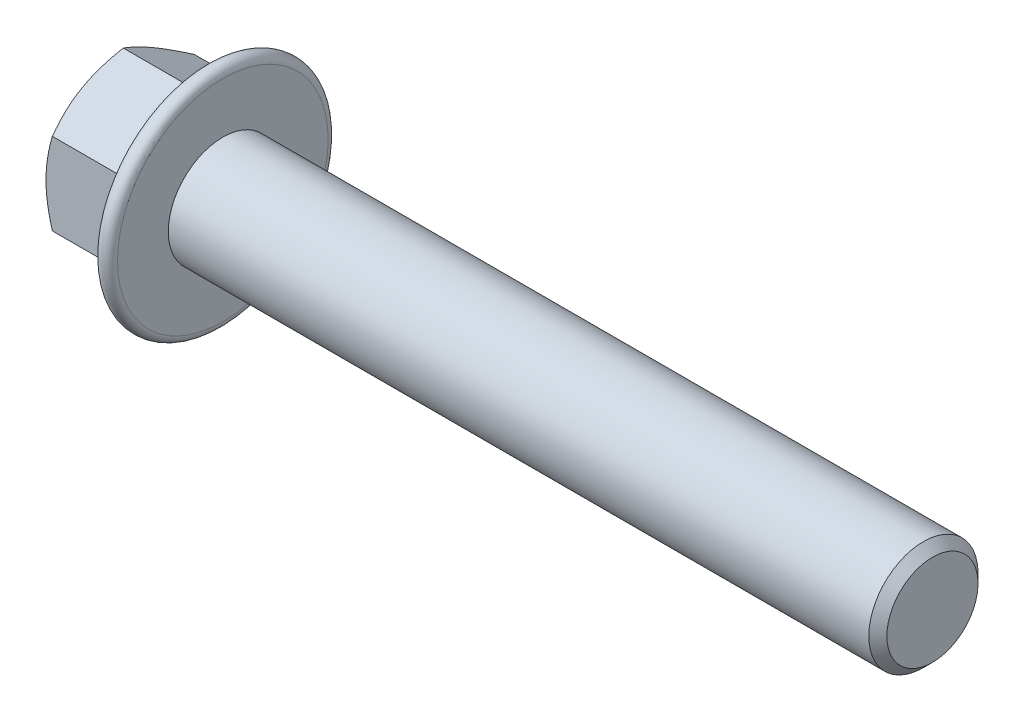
SolidWorks part; units mm, degrees
extrude "BaseHead" add sketch "Sketch1" along normal blind 9.7
sketch "Sketch1" plane through (0, 0, 0) normal (1, 0, 0) x (0, 0, -1)
  line L0 (6.5, 3.7528) -> (6.5, -3.7528)
  line L1 (-6.5, 3.7528) -> (-6.5, -3.7528)
  line L2 (6.5, -3.7528) -> (0, -7.5056)
  line L3 (0, -7.5056) -> (-6.5, -3.7528)
  line L4 (6.5, 3.7528) -> (0, 7.5056)
  line L5 (0, 7.5056) -> (-6.5, 3.7528)
ref_plane "Plane1" through (0, 0, 0) normal (0, 0, 1) x (1, 0, 0)
ref_plane "Plane2" through (0, 0, 0) normal (0, 1, 0) x (1, 0, 0)
ref_plane "Plane3" through (0, 0, 0) normal (1, 0, 0) x (0, 0, -1)
sketch "BodySke" plane through (0, 0, 0) normal (0, 0, 1) x (1, 0, 0)
  line L0 (0, 3.7528) -> (0, -3.7528) construction
  line L1 (0, 0) -> (74.7, 0)
  line L2 (0, 0) -> (0, 5)
  line L3 (0, 5) -> (73.872, 5)
  line L4 (74.7, 0) -> (74.7, 4.172)
  line L5 (9.7, 7.5056) -> (9.7, 3.7528) construction
  line L6 (74.7, 4.172) -> (73.872, 5)
  line L7 (0, 0) -> (96.52, 0) construction
  line L8 (74.7, -4.172) -> (73.872, -5) construction
  line L9 (0, -5) -> (73.872, -5) construction
  line L10 (11.2, 15.24) -> (11.2, -1.27) construction
  line L11 (48.7, 15.24) -> (48.7, -1.27) construction
  line L12 (9.7, 3.7528) -> (9.7, -3.7528) construction
revolve "BaseBody" add sketch "BodySke"
fillet "HeadFillet" [suppressed] radius 0.4
sketch "Sketch3" plane through (0, 0, 0) normal (0, 0, 1) x (1, 0, 0)
  line L0 (0, 6.5) -> (3.4673, 12.5056)
  line L1 (0, 7.5056) -> (0, 3.7528) construction
  line L2 (3.4673, 12.5056) -> (3.4673, 17.5056)
  line L3 (3.4673, 17.5056) -> (-10, 17.5056)
  line L4 (-10, 17.5056) -> (-10, 6.5)
  line L5 (-10, 6.5) -> (0, 6.5)
  line L6 (0, 0) -> (99.06, 0) construction
  line L7 (9.7, 7.5056) -> (0, 7.5056) construction
revolve "HeadChamfer" cut sketch "Sketch3" angle 360 about L6
sketch "Sketch4" plane through (0, 0, 0) normal (0, 0, 1) x (1, 0, 0)
  line L0 (4.6396, 0) -> (8.2452, 9.9065)
  line L1 (9.7, 7.5056) -> (9.7, 3.7528) construction
  line L2 (8.2, 34.3444) -> (8.2, 16.9779) construction
  line L3 (9.7, 0) -> (9.7, 9.65)
  line L4 (8.3021, 10.4) -> (20.1618, 10.4) construction
  line L5 (0, 0) -> (95.25, 0) construction
  line L6 (0, 0) -> (96.52, 0) construction
  line L7 (4.6396, 0) -> (9.7, 0)
  line L8 (8.3021, -10.4) -> (20.1618, -10.4) construction
  arc A0 (9.7, 9.65) -> (8.2452, 9.9065) centre (8.95, 9.65) ccw
  dimension "D1" = 20
  dimension "Flange_thickness" = 1.5
  dimension "Flange_dia" = 20.8
revolve "Flange" add sketch "Sketch4" angle 360 about L5
fillet "FlangeHexFillet" radius 0.6 6 edges
sketch "ThdSchSke" plane through (0, 0, 0) normal (0, 0, 1) x (1, 0, 0)
  line L0 (48.7, -4.172) -> (48.1202, -5)
  line L1 (48.7, -4.172) -> (49.2798, -5)
  line L2 (49.2798, -5) -> (49.2798, -6.25)
  line L3 (-3.175, 0) -> (5.1513, 0) construction
  line L5 (49.2798, -6.25) -> (48.1202, -6.25)
  line L6 (48.1202, -6.25) -> (48.1202, -5)
revolve "ThreadSchematic" [suppressed] cut sketch "ThdSchSke" angle 360 about L3
pattern_linear "ThdSchPat" [suppressed]
equation "\"D3@Sketch1\" = \"Width_flats@Sketch1\" / 2"
equation "\"D4@Sketch1\" = \"D3@Sketch1\""
equation "\"D5@Sketch1\" = \"D4@Sketch1\""
equation "\"Thread_minor@ThreadCosmetic\" = \"Minor_dia@BodySke\""
equation "\"D1@Sketch3\" = \"Width_flats@Sketch1\" / 2"
equation "\"Thread_length@ThreadCosmetic\" = ((sgn( (\"Length@BodySke\" - \"Advance@BodySke\" ) - \"Thread_nom@BodySke\" )-1)*( (\"Length@BodySke\" - \"Advance@BodySke\" ) - \"Thread_nom@BodySke\" ))/-2+ \"Thread_nom@BodySke\""
equation "\"Thread_minor@ThdSchSke\" = \"Minor_dia@BodySke\""
equation "\"Diameter@ThdSchSke\" = \"Diameter@BodySke\""
equation "\"Overcut@ThdSchSke\" = \"Diameter@BodySke\" * 1.25"
equation "\"Start@ThdSchSke\" = \"Head_ht@BaseHead\" + \"Length@BodySke\" - \"Thread_length@ThreadCosmetic\"  '---Non-countersunk---"
equation "\"Num_threads@ThdSchPat\" = int( \"Thread_length@ThreadCosmetic\" / \"Advance@BodySke\" + 0.999 )  + 1"
equation "\"Advance@ThdSchPat\" = \"Thread_length@ThreadCosmetic\" /  (\"Num_threads@ThdSchPat\" - 1) 'relax it"
equation "\"Num_threads@ThdSchPat\" = \"Num_threads@ThdSchPat\" - sgn( \"Num_threads@ThdSchPat\" - 1) '---chamfered tips only---"
